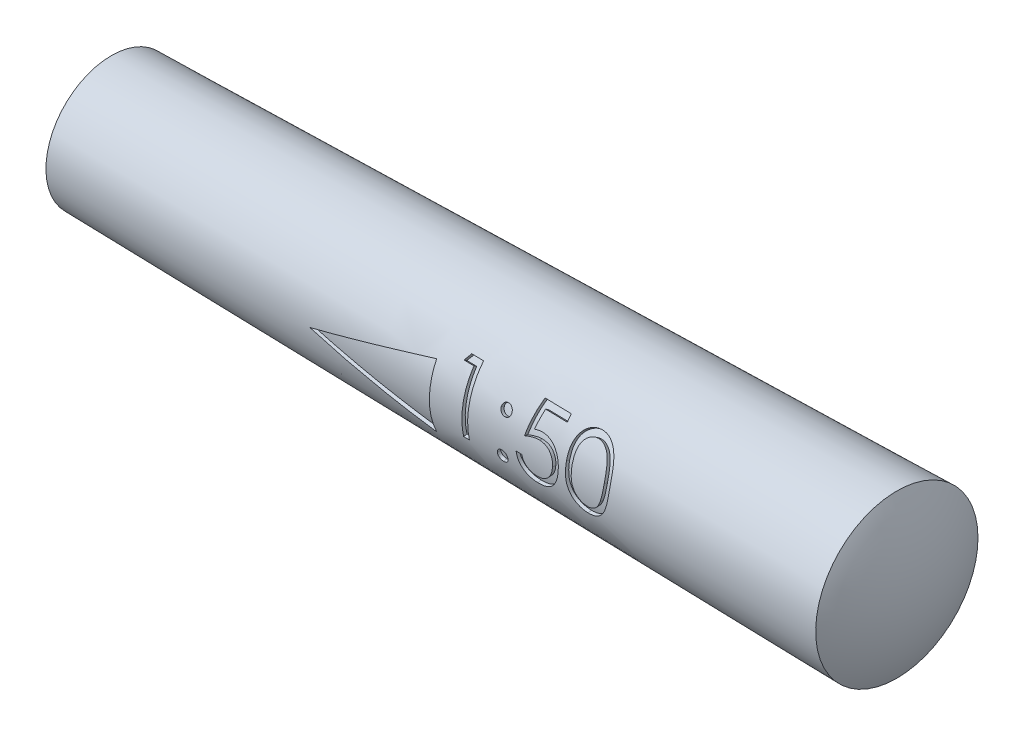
SolidWorks part; units mm, degrees
ref_plane "Front Plane" through (0, 0, 0) normal (0, 0, 1) x (1, 0, 0)
ref_plane "Top Plane" through (0, 0, 0) normal (0, 1, 0) x (1, 0, 0)
ref_plane "Right Plane" through (0, 0, 0) normal (1, 0, 0) x (0, 0, -1)
sketch "Sketch1" plane through (0, 0, 0) normal (1, 0, 0) x (0, 0, -1)
  circle A0 centre (0, 0) radius 1
  dimension "D1" = 2
extrude "Extrude1" add sketch "Sketch1" along normal mid plane 12
draft "Draft1" type of draft neutral plane draft angle 1.146 faces to draft 1 parameters "D1"=1.146
sketch "Sketch2" plane through (0, 0, 0) normal (0, 0, 1) x (1, 0, 0)
  line L0 (-6, 0) -> (-6, 1)
  line L1 (-6, 1) -> (-6, -1) construction
  line L2 (-6, 0) -> (-6.3, 0)
  line L3 (-6.3, 0) -> (-6.3, -1.12) construction
  line L4 (6, 0) -> (6, 1.24)
  line L5 (6, -1.24) -> (6, 1.24) construction
  line L6 (6, 0) -> (6.3, 0)
  line L7 (6.3, 0) -> (6.3, -1.12) construction
  line L8 (-6, -1) -> (6, -1.24) construction
  arc A0 (-6.3, 0) -> (-6, 1) centre (-4.4833, 0) cw
  arc A1 (6.3, 0) -> (6, 1.24) centre (3.5873, 0) ccw
  point P14 (0, -1.12)
revolve "Revolve1" add sketch "Sketch2" angle 360 about L2
sketch "Sketch5" plane through (0, 0, 0) normal (0, 0, 1) x (1, 0, 0)
  line L0 (0, 1.12) -> (0, -1.12) construction
  line L1 (6, 1.24) -> (-6, 1) construction
  line L2 (-6, -1) -> (6, -1.24) construction
ref_plane "Plane2" through (0, 0, 0) normal (-0.02, 0, 0.9998) x (0.9998, 0, 0.02)
sketch "Sketch6" plane through (0, 0, 0) normal (-0.02, 0, 0.9998) x (0.9998, 0, 0.02)
  line L0 (0, 0) -> (0, 0.5)
  line L1 (0, 1.12) -> (0, -1.12) construction
  line L2 (0, 0.5) -> (-1.866, 0)
  line L3 (-1.866, 0) -> (0, -0.5)
  line L4 (0, -0.5) -> (0, 0)
  line L5 (0, -0.25) -> (3, -0.25) construction
  text T0 "1:50" font "Century Gothic" height 1
  dimension "D1" = 1
  dimension "D2" = 30
  dimension "D3" = 3
wrap "Wrap2" sketch "Sketch6" wrap type deboss source sketch "Sketch6" thickness 0.05 parameters "D1"=0.05
equation "\"D2@Sketch2\" = \"D1@Sketch2\""
